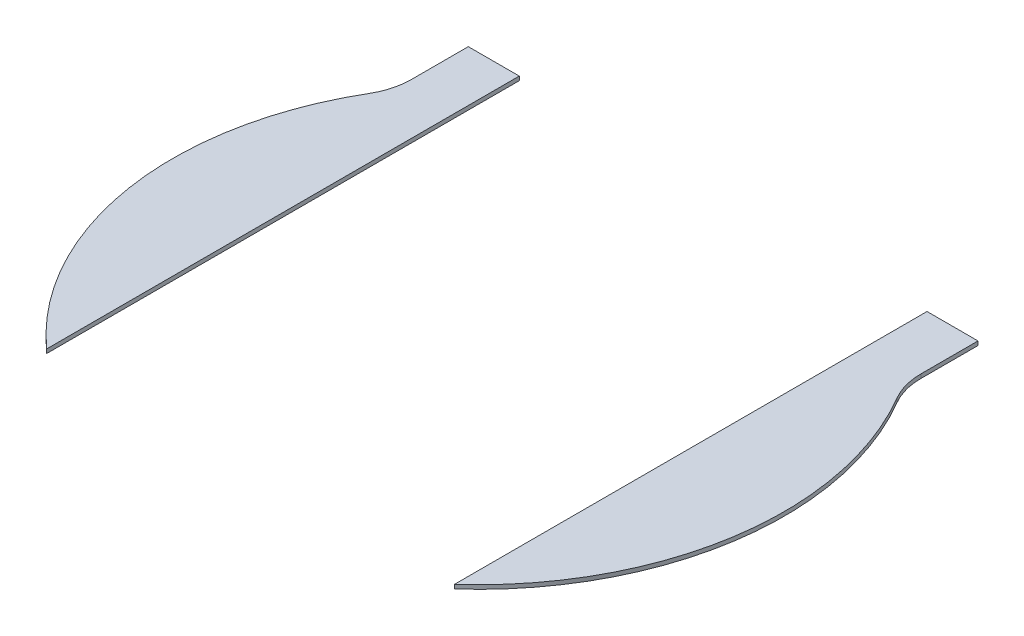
SolidWorks part; units mm, degrees
ref_plane "Front Plane" through (0, 0, 0) normal (0, 0, 1) x (1, 0, 0)
ref_plane "Top Plane" through (0, 0, 0) normal (0, 1, 0) x (1, 0, 0)
ref_plane "Right Plane" through (0, 0, 0) normal (1, 0, 0) x (0, 0, -1)
sketch "Sketch1" plane through (0, 0, 0) normal (0, 1, 0) x (1, 0, 0)
  line L0 (-3.175, 2.3383) -> (-3.175, 3.048)
  line L1 (3.175, 2.3383) -> (3.175, 3.048)
  line L2 (2.54, -2.8398) -> (2.54, 3.048)
  line L3 (-2.54, -2.8398) -> (-2.54, 3.048)
  line L4 (3.175, 3.048) -> (2.54, 3.048)
  line L5 (-2.54, 3.048) -> (-3.175, 3.048)
  arc A0 (-3.2866, 1.9272) -> (-2.54, -2.8398) centre (0, 0) ccw
  arc A1 (2.54, -2.8398) -> (3.2866, 1.9272) centre (0, 0) ccw
  arc A2 (-3.2866, 1.9272) -> (-3.175, 2.3383) centre (-3.9878, 2.3383) ccw
  arc A3 (-3.2866, 1.9272) -> (-3.175, 2.3383) centre (-3.9878, 2.3383) ccw
  arc A4 (3.175, 2.3383) -> (3.2866, 1.9272) centre (3.9878, 2.3383) ccw
extrude "Extrude1" add sketch "Sketch1" along normal blind 0.05 contours A2 A0 L3 L5 L0 | A4 L1 L4 L2 A1
